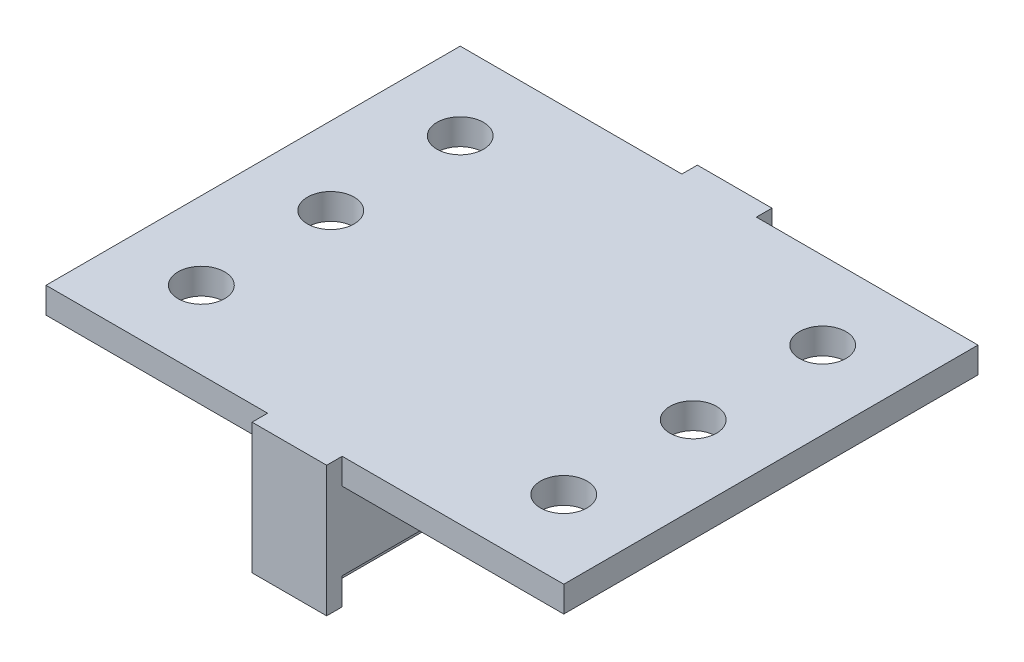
SolidWorks part; units mm, degrees
ref_plane "Front Plane" through (0, 0, 0) normal (0, 0, 1) x (1, 0, 0)
ref_plane "Top Plane" through (0, 0, 0) normal (0, 1, 0) x (1, 0, 0)
ref_plane "Right Plane" through (0, 0, 0) normal (1, 0, 0) x (0, 0, -1)
sketch "Sketch1" plane through (0, 0, 0) normal (0, 0, 1) x (1, 0, 0)
  line L0 (52.4, 20.8126) -> (47.6, 20.8126)
  line L1 (47.6, 20.8126) -> (47.6, 26.0126)
  line L2 (47.6, 26.0126) -> (42.8, 26.0126)
  line L3 (42.8, 26.0126) -> (42.8, 41.0126)
  line L4 (42.8, 41.0126) -> (0, 41.0126)
  line L5 (0, 41.0126) -> (0, 46.0126)
  line L6 (0, 46.0126) -> (100, 46.0126)
  line L7 (100, 46.0126) -> (100, 41.0126)
  line L8 (52.4, 20.8126) -> (52.4, 26.0126)
  line L9 (52.4, 26.0126) -> (57.2, 26.0126)
  line L10 (57.2, 26.0126) -> (57.2, 41.0126)
  line L11 (57.2, 41.0126) -> (100, 41.0126)
  dimension "D1" = 100
  dimension "D2" = 5
  dimension "D3" = 4.8
  dimension "D4" = 5.2
  dimension "D5" = 15
extrude "Boss-Extrude1" add sketch "Sketch1" along normal blind 80
hole_wizard "M10x1.0 Tapped Hole1" positions "Sketch3" profile "Sketch2" tap size "M10x1.0" standard "ANSI Metric"
sketch "Sketch3" plane through (0, 46.0126, 0) normal (0, 1, 0) x (1, 0, 0)
  line L0 (100, -80) -> (0, -80) construction
  line L1 (100, 0) -> (0, 0) construction
  line L2 (0, -80) -> (0, 0) construction
  line L3 (100, -80) -> (100, 0) construction
  point P0 (15, -65)
  point P2 (15, -40)
  point P4 (15, -15)
  point P6 (85, -15)
  point P8 (85, -40)
  point P10 (85, -65)
  dimension "D1" = 15
  dimension "D2" = 15
  dimension "D3" = 25
  dimension "D4" = 15
  dimension "D5" = 15
sketch "Sketch2" plane through (15, 46.0126, 65) normal (1, 0, 0) x (0, 0, 1)
  line L0 (0, 0) -> (0, 25.2)
  line L1 (0, 25.2) -> (4.5, 25.2)
  line L2 (4.5, 25.2) -> (4.5, 0)
  line L5 (4.5, 0) -> (0, 0)
  line L11 (0, -6.35) -> (0, 107.95) construction
  dimension "Thread Major Dia." = 9
  dimension "Thru Tap Drill Depth" = 25.2
sketch "Sketch4" plane through (0, 0, 80) normal (0, 0, 1) x (1, 0, 0)
  line L1 (42.8, 41.0126) -> (42.8, 26.0126) construction
  line L2 (57.2, 26.0126) -> (57.2, 41.0126) construction
  line L3 (47.6, 20.8126) -> (52.4, 20.8126) construction
  line L4 (42.8, 46.0126) -> (42.8, 20.8126)
  line L6 (57.2, 20.8126) -> (57.2, 46.0126)
  line L7 (42.8, 20.8126) -> (57.2, 20.8126)
  line L8 (100, 46.0126) -> (0, 46.0126) construction
  line L10 (42.8, 46.0126) -> (57.2, 46.0126)
extrude "Boss-Extrude2" add sketch "Sketch4" along normal blind 3
ref_plane "Plane1" through (0, 0, 40) normal (0, 0, 1) x (1, 0, 0)
mirror "Mirror1" about plane through (0, 0, 40) normal (0, 0, 1) of "Boss-Extrude2"
